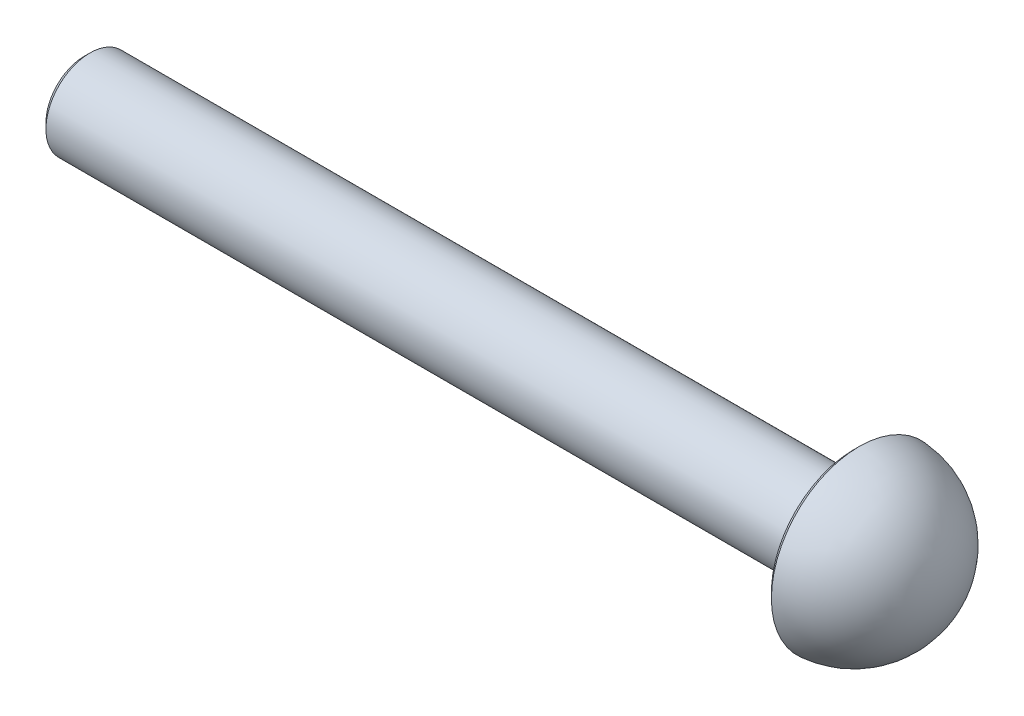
SolidWorks part; units mm, degrees
ref_plane "Спереди" through (0, 0, 0) normal (0, 0, 1) x (1, 0, 0)
ref_plane "Сверху" through (0, 0, 0) normal (0, 1, 0) x (1, 0, 0)
ref_plane "Справа" through (0, 0, 0) normal (1, 0, 0) x (0, 0, -1)
sketch "Эскиз1" plane through (0, 0, 0) normal (0, 0, 1) x (1, 0, 0)
  line L0 (0, 0) -> (0, 2)
  line L1 (0, 2) -> (35, 2)
  line L2 (35, 2) -> (35, 4)
  line L3 (0, 0) -> (39, 0)
  arc A0 (39, 0) -> (35, 4) centre (35, 0) ccw
  dimension "D3" = 8
  dimension "D1" = 2
  dimension "D2" = 35
revolve "Повернуть1" add sketch "Эскиз1" angle 360 about L3
chamfer "Фаска1" distance 0.25 angle 45 3 edges at (35, 0, 2) (0, 0, 2) (35, 0, 4)
